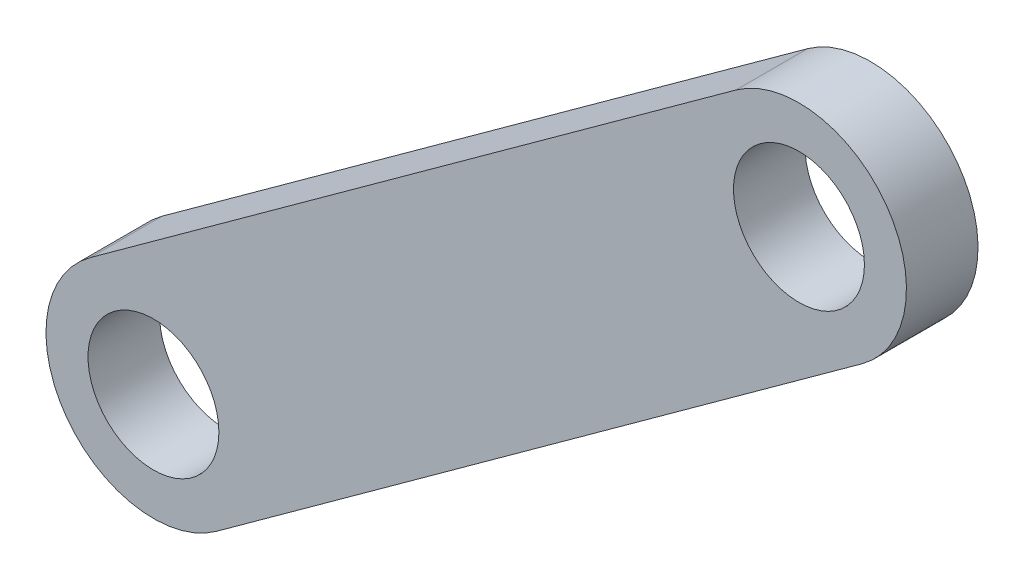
SolidWorks part; units mm, degrees
ref_plane "Front Plane" through (0, 0, 0) normal (0, 0, 1) x (1, 0, 0)
ref_plane "Top Plane" through (0, 0, 0) normal (0, 1, 0) x (1, 0, 0)
ref_plane "Right Plane" through (0, 0, 0) normal (1, 0, 0) x (0, 0, -1)
sketch "Sketch1" plane through (0, 0, 0) normal (0, 0, 1) x (1, 0, 0)
sketch_block_instance "Block3-1"
sketch_block "Block3"
extrude "Extrude1" add sketch "Sketch1" along normal mid plane 4
sketch "Sketch2" plane through (0, 0, 2) normal (0, 0, 1) x (1, 0, 0)
  point P0 (42.5843, 31.59)
